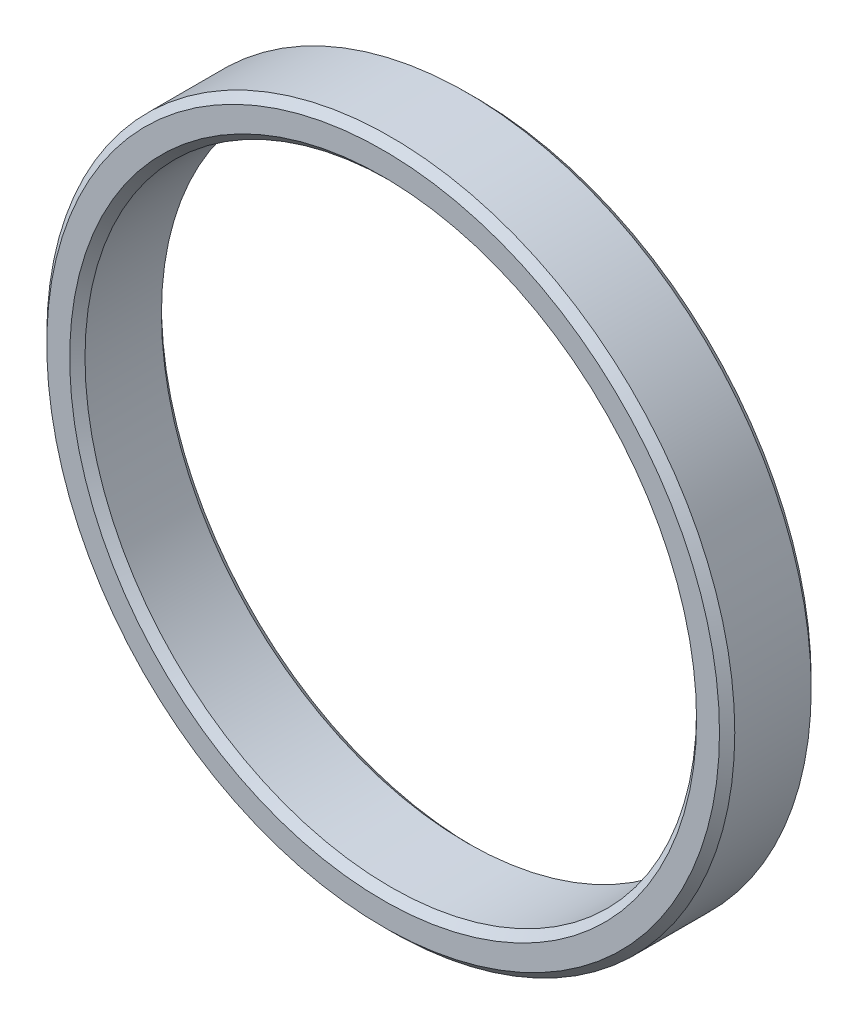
SolidWorks part; units mm, degrees
ref_plane "Face" through (0, 0, 0) normal (0, 0, 1) x (1, 0, 0)
ref_plane "Dessus" through (0, 0, 0) normal (0, 1, 0) x (1, 0, 0)
ref_plane "Droite" through (0, 0, 0) normal (1, 0, 0) x (0, 0, -1)
sketch "Esquisse1" plane through (0, 0, 0) normal (0, 0, 1) x (1, 0, 0)
  circle A0 centre (0, 0) radius 22.5
  circle A1 centre (0, 0) radius 20
  dimension "D1" = 40
  dimension "D2" = 45
extrude "Base-Extrusion" add sketch "Esquisse1" along normal blind 6
chamfer "Chanfrein1" distance 0.5 angle 45
